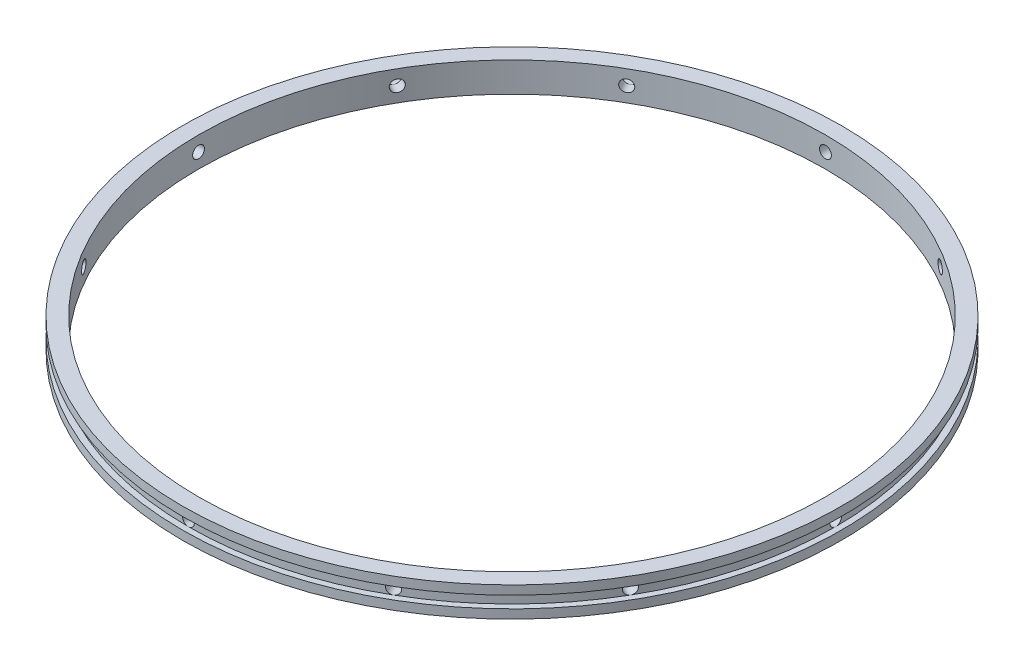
SolidWorks part; units mm, degrees
ref_plane "Front Plane" through (0, 0, 0) normal (0, 0, 1) x (1, 0, 0)
ref_plane "Top Plane" through (0, 0, 0) normal (0, 1, 0) x (1, 0, 0)
ref_plane "Right Plane" through (0, 0, 0) normal (1, 0, 0) x (0, 0, -1)
sketch "Sketch1-Lander Rotor Turntable Master sketch rev2" plane through (0, 0, 0) normal (0, 0, 1) x (1, 0, 0)
  line L0 (0, 0) -> (0, 36.1163) construction
  line L1 (54.356, 36.1163) -> (-54.356, 36.1163) construction
  line L2 (0, -76.5962) -> (50.8, -76.5962) construction
  line L3 (0, 0) -> (0, -76.5962) construction
  line L4 (0, 137.7163) -> (139.7, 137.7163)
  line L5 (139.7, 137.7163) -> (139.7, 112.3163)
  line L6 (139.7, 112.3163) -> (76.2, 112.3163)
  line L7 (76.2, 112.3163) -> (76.2, 39.2913)
  line L8 (50.8, -154.018) -> (50.8, -185.7527) construction
  line L9 (54.356, -189.3087) -> (-54.356, -189.3087) construction
  line L10 (38.1, -187.7212) -> (50.8254, -187.7212)
  line L12 (38.1, -187.7212) -> (38.1, -189.3087)
  line L13 (38.1, -189.3087) -> (38.1, -211.5337)
  line L14 (38.1, -211.5337) -> (64.8249, -211.5337)
  line L15 (104.9147, -187.7212) -> (104.9147, -182.4888)
  line L16 (104.9147, -182.4888) -> (113.8555, -182.4888)
  line L17 (0, -249.4089) -> (0, -76.5962) construction
  line L18 (0, 36.1163) -> (0, 137.7163) construction
  line L19 (0, -153.1925) -> (51.6255, -153.1925) construction
  line L20 (0, -153.1925) -> (-51.6255, -153.1925) construction
  line L21 (-78.5813, -156.0982) -> (-78.5813, -178.1658) construction
  line L22 (-65.4152, -152.7962) -> (-75.2793, -152.7962) construction
  line L23 (-73.7247, -178.9913) -> (-65.4152, -152.7962) construction
  line L24 (-77.7558, -178.9913) -> (-73.7247, -178.9913) construction
  line L25 (-58.9777, -150.6381) -> (-60.6029, -150.1668) construction
  line L26 (-59.3967, -152.0828) -> (-58.9777, -150.6381) construction
  line L27 (-60.119, -151.8733) -> (-59.3967, -152.0828) construction
  line L28 (-69.7973, -185.2447) -> (-60.119, -151.8733) construction
  line L29 (-71.2419, -184.8258) -> (-69.7973, -185.2447) construction
  line L30 (-61.3018, -150.5514) -> (-71.2419, -184.8258) construction
  line L31 (-64.8249, -180.7393) -> (-64.8249, -189.3087) construction
  line L32 (-61.8583, -181.5997) -> (-64.8249, -180.7393) construction
  line L33 (-55.9856, -159.2876) -> (-61.8583, -181.5997) construction
  line L34 (-58.9697, -158.4222) -> (-55.9856, -159.2876) construction
  line L35 (-58.9697, -153.1925) -> (-58.9697, -158.4222) construction
  line L36 (-64.8249, 36.1163) -> (-54.356, 36.1163) construction
  line L37 (-50.8, 32.5603) -> (-50.8, 0.8255) construction
  line L38 (-51.6255, 0) -> (-58.9697, 0) construction
  line L39 (-58.9697, 0) -> (-58.9697, 5.2297) construction
  line L40 (-58.9697, 5.2297) -> (-55.9856, 6.0951) construction
  line L41 (-55.9856, 6.0951) -> (-61.8583, 28.4072) construction
  line L42 (-61.8583, 28.4072) -> (-64.8249, 27.5468) construction
  line L43 (-64.8249, 27.5468) -> (-64.8249, 36.1163) construction
  line L44 (-61.3018, -2.6411) -> (-71.2419, 31.6333) construction
  line L45 (-71.2419, 31.6333) -> (-69.7973, 32.0523) construction
  line L46 (-69.7973, 32.0523) -> (-60.119, -1.3192) construction
  line L47 (-60.119, -1.3192) -> (-59.3967, -1.1097) construction
  line L48 (-59.3967, -1.1097) -> (-58.9777, -2.5543) construction
  line L49 (-58.9777, -2.5543) -> (-60.6029, -3.0257) construction
  line L50 (-77.7558, 25.7988) -> (-73.7247, 25.7988) construction
  line L51 (-73.7247, 25.7988) -> (-65.4152, -0.3962) construction
  line L52 (-65.4152, -0.3962) -> (-75.2793, -0.3962) construction
  line L53 (-78.5813, 2.9058) -> (-78.5813, 24.9733) construction
  line L54 (59.3967, -1.1097) -> (60.119, -1.3192) construction
  line L55 (60.119, -1.3192) -> (69.7973, 32.0523) construction
  line L56 (69.7973, 32.0523) -> (71.2419, 31.6333) construction
  line L57 (71.2419, 31.6333) -> (61.3018, -2.6411) construction
  line L58 (60.6029, -3.0257) -> (58.9777, -2.5543) construction
  line L59 (58.9777, -2.5543) -> (59.3967, -1.1097) construction
  line L60 (73.7247, 25.7988) -> (77.7557, 25.7988) construction
  line L61 (78.5812, 24.9733) -> (78.5813, 2.9058) construction
  line L62 (75.2793, -0.3962) -> (65.4152, -0.3962) construction
  line L63 (65.4152, -0.3962) -> (73.7247, 25.7988) construction
  line L64 (54.356, 36.1163) -> (64.8249, 36.1163) construction
  line L65 (64.8249, 36.1163) -> (64.8249, 27.5468) construction
  line L66 (64.8249, 27.5468) -> (61.8583, 28.4072) construction
  line L67 (61.8583, 28.4072) -> (55.9856, 6.0951) construction
  line L68 (55.9856, 6.0951) -> (58.9697, 5.2297) construction
  line L69 (58.9697, 5.2297) -> (58.9697, 0) construction
  line L70 (58.9697, 0) -> (51.6255, 0) construction
  line L71 (50.8, 0.8255) -> (50.8, 32.5603) construction
  line L72 (0, 0) -> (-51.6255, 0) construction
  line L73 (0, 0) -> (51.6255, 0) construction
  line L74 (-51.6255, -153.1925) -> (-58.9697, -153.1925) construction
  line L75 (-50.8, -185.7527) -> (-50.8, -154.018) construction
  line L76 (-64.8249, -189.3087) -> (-54.356, -189.3087) construction
  line L77 (0, -153.1925) -> (0, -189.3087) construction
  line L78 (58.9697, -153.1925) -> (51.6255, -153.1925) construction
  line L79 (58.9697, -158.4222) -> (58.9697, -153.1925) construction
  line L80 (55.9856, -159.2876) -> (58.9697, -158.4222) construction
  line L81 (61.8583, -181.5997) -> (55.9856, -159.2876) construction
  line L82 (64.8249, -180.7393) -> (61.8583, -181.5997) construction
  line L83 (64.8249, -189.3087) -> (64.8249, -180.7393) construction
  line L84 (54.356, -189.3087) -> (64.8249, -189.3087) construction
  line L85 (65.4152, -152.7962) -> (73.7247, -178.9913) construction
  line L86 (75.2793, -152.7962) -> (65.4152, -152.7962) construction
  line L87 (78.5812, -178.1658) -> (78.5812, -156.0982) construction
  line L88 (73.7247, -178.9913) -> (77.7557, -178.9913) construction
  line L89 (58.9777, -150.6381) -> (59.3967, -152.0828) construction
  line L90 (60.6029, -150.1668) -> (58.9777, -150.6381) construction
  line L91 (71.2419, -184.8258) -> (61.3018, -150.5514) construction
  line L92 (69.7973, -185.2447) -> (71.2419, -184.8258) construction
  line L93 (60.119, -151.8733) -> (69.7973, -185.2447) construction
  line L94 (59.3967, -152.0828) -> (60.119, -151.8733) construction
  line L95 (74.3669, 36.1163) -> (50.8254, 36.1163)
  line L96 (50.8254, 36.1163) -> (50.8254, -187.7212)
  line L97 (78.5558, -184.5462) -> (78.5559, -152.7962)
  line L98 (78.5559, -152.7962) -> (65.4152, -152.7962)
  line L99 (65.4152, -152.7962) -> (65.4152, -0.3962)
  line L100 (65.4152, -0.3962) -> (78.5558, -0.3962)
  line L101 (78.5558, -0.3962) -> (78.5559, 39.2913)
  line L102 (80.3889, 42.4663) -> (88.9, 42.4663)
  line L103 (88.9, 42.4663) -> (88.9, 75.8038)
  line L104 (89.8165, 77.3913) -> (125.4125, 77.3913)
  line L105 (125.4125, 77.3913) -> (125.4125, -186.1337)
  line L109 (76.2, 39.2913) -> (74.3669, 36.1163)
  line L110 (88.9, 75.8038) -> (89.8165, 77.3913)
  line L112 (78.5559, 39.2913) -> (80.3889, 42.4663)
  line L148 (80.3889, -187.7212) -> (123.825, -187.7212)
  line L149 (78.5558, -184.5462) -> (80.3889, -187.7212)
  line L150 (38.1, -213.1212) -> (44.8818, -213.1212)
  line L151 (38.1, -211.5337) -> (38.1, -213.1212)
  line L152 (44.8818, -213.1212) -> (44.8818, -281.5337)
  line L153 (43.2943, -283.1212) -> (24.9746, -283.1212)
  line L154 (44.8818, -281.5337) -> (43.2943, -283.1212)
  line L155 (123.825, -187.7212) -> (125.4125, -186.1337)
  line L156 (131.7625, -132.1587) -> (131.7625, -126.9263) construction
  line L157 (131.7625, -126.9263) -> (140.7033, -126.9263) construction
  line L161 (140.7033, -126.9263) -> (140.7033, -132.1587) construction
  line L167 (125.6665, -132.1587) -> (125.6665, -182.9587)
  line L168 (50.8254, -149.9413) -> (45.1104, -149.9413) construction
  line L169 (145.7833, -126.9263) -> (145.7833, -132.1587) construction
  line L170 (45.1104, -149.9413) -> (45.1104, -153.1163) construction
  line L171 (45.1104, -153.1163) -> (50.8254, -153.1163) construction
  line L172 (64.8249, -211.5337) -> (64.8249, -189.3087)
  line L174 (64.8249, -189.3087) -> (38.1, -189.3087)
  line L175 (51.4625, -211.5337) -> (51.4625, -189.3087) construction
  line L176 (64.8249, -200.4212) -> (51.4625, -200.4212) construction
  line L177 (154.7241, -126.9263) -> (154.7241, -132.1587) construction
  line L182 (154.7241, -126.9263) -> (145.7833, -126.9263) construction
  line L184 (81.9, -187.7212) -> (125.4125, -187.7212)
  line L185 (431.8, -182.9587) -> (431.8, -132.1587)
  line L186 (431.8, -132.1587) -> (203.2, -132.1587)
  line L187 (81.9, -218.1225) -> (98.1397, -218.1225)
  line L189 (304.8, -221.0587) -> (304.8, -182.9587)
  line L190 (81.9, -218.1225) -> (81.9, -187.7212)
  line L193 (81.9, -187.7212) -> (80.3889, -187.7212)
  line L194 (98, -218.1225) -> (98, -236.1225) construction
  line L195 (98, -236.1225) -> (74.5, -236.1225) construction
  line L196 (74.5, -236.1225) -> (74.5, -438.649) construction
  line L199 (74.5, -438.649) -> (0, -438.649) construction
  line L203 (0, -438.649) -> (0, -428.649)
  line L204 (0, -428.649) -> (81.9, -428.649) construction
  line L205 (81.9, -428.649) -> (81.9, -218.1225) construction
  line L206 (89.0397, -187.7212) -> (89.0397, -182.4888)
  line L207 (89.0397, -182.4888) -> (97.9805, -182.4888)
  line L208 (97.9805, -182.4888) -> (97.9805, -187.7212)
  line L210 (125.4125, -94.0587) -> (203.2, -94.0587)
  line L211 (203.2, -94.0587) -> (203.2, -132.1587)
  line L213 (78.5559, -168.6712) -> (125.4125, -168.6712) construction
  line L214 (0, 137.7163) -> (0, 188.5163)
  line L215 (0, -249.4089) -> (0, 137.7163)
  line L219 (304.8, -259.1587) -> (304.8, -221.0587)
  line L220 (304.8, -259.1587) -> (279.4, -259.1587) construction
  line L221 (260.35, -278.2087) -> (260.35, -817.9587) construction
  line L222 (260.35, -817.9587) -> (0, -817.9587) construction
  line L225 (0, -817.9587) -> (0, -792.5587) construction
  line L226 (0, -792.5587) -> (228.6, -792.5587) construction
  line L228 (50.8254, -140.4925) -> (47.6504, -140.4925)
  line L229 (47.6504, -140.4925) -> (47.6504, -12.7)
  line L230 (47.6504, -12.7) -> (50.8254, -12.7)
  line L231 (203.2, -132.1587) -> (125.4125, -132.1587)
  line L238 (254, -767.1587) -> (254, -221.0587) construction
  line L239 (203.454, -218.1225) -> (203.454, -221.0587)
  line L240 (203.454, -239.6719) -> (127, -239.6719) construction
  line L241 (0, -249.4089) -> (0, -420.074) construction
  line L242 (127, -239.6719) -> (127, -218.1225) construction
  line L243 (152.4, -239.6719) -> (152.4, -407.9469) construction
  line L244 (152.4, -407.9469) -> (127, -407.9469) construction
  line L245 (127, -407.9469) -> (127, -239.6719) construction
  line L246 (127, -407.9469) -> (203.454, -407.9469) construction
  line L247 (203.454, -407.9469) -> (203.454, -433.3469) construction
  line L248 (203.454, -433.3469) -> (127, -433.3469) construction
  line L249 (127, -433.3469) -> (127, -407.9469) construction
  line L250 (203.454, -221.0587) -> (304.8, -221.0587)
  line L251 (43.2943, -283.1212) -> (71, -283.1212) construction
  line L252 (203.454, -221.0587) -> (203.454, -239.6719) construction
  line L253 (71, -283.1212) -> (71, -420.074) construction
  line L254 (125.6665, -182.9587) -> (304.8, -182.9587)
  line L255 (125.6665, -182.9587) -> (125.4125, -182.9587)
  line L256 (125.6665, -182.9587) -> (125.6665, -187.7212)
  line L257 (125.6665, -187.7212) -> (125.4125, -187.7212)
  line L258 (304.8, -182.9587) -> (431.8, -182.9587)
  line L259 (71, -420.074) -> (0, -420.074) construction
  line L260 (76.2, 112.3163) -> (76.2, 137.7163)
  line L261 (76.327, 112.3163) -> (76.327, 137.7163)
  line L262 (98.1397, -218.1225) -> (98.1397, -220.6219)
  line L263 (98.1397, -220.6219) -> (126.746, -220.6219)
  line L264 (24.9746, -283.1212) -> (24.9746, -353.1542)
  line L265 (24.9746, -353.1542) -> (0, -353.1542)
  line L266 (0, -353.1542) -> (0, -249.4089)
  line L267 (24.9746, -346.8042) -> (23.1902, -346.8042)
  line L268 (23.1902, -346.8042) -> (23.1902, -343.1212)
  line L269 (23.1902, -343.1212) -> (24.9746, -343.1212)
  line L270 (0, 188.5163) -> (139.7, 188.5163)
  line L271 (139.7, 188.5163) -> (139.7, 137.7163)
  line L272 (127, -239.6719) -> (126.746, -239.6719) construction
  line L273 (126.746, -239.6719) -> (126.746, -220.6219) construction
  line L274 (127, -218.1225) -> (203.454, -218.1225)
  line L275 (126.746, -220.6219) -> (126.746, -218.1225)
  line L276 (126.746, -218.1225) -> (127, -218.1225)
  line L277 (113.8555, -182.4888) -> (113.8555, -187.7212)
  arc A0 (50.8, -154.018) -> (51.6255, -153.1925) centre (51.6255, -154.018) cw construction
  arc A1 (-77.7558, -178.9913) -> (-78.5813, -178.1658) centre (-77.7558, -178.1658) cw construction
  arc A2 (-78.5813, -156.0982) -> (-75.2793, -152.7962) centre (-75.2793, -156.0982) cw construction
  arc A3 (-61.3018, -150.5514) -> (-60.6029, -150.1668) centre (-60.7601, -150.7085) cw construction
  arc A4 (-51.6255, -153.1925) -> (-50.8, -154.018) centre (-51.6255, -154.018) cw construction
  arc A5 (-50.8, -185.7527) -> (-54.356, -189.3087) centre (-54.356, -185.7527) cw construction
  arc A6 (54.356, -189.3087) -> (50.8, -185.7527) centre (54.356, -185.7527) cw construction
  arc A7 (75.2793, -152.7962) -> (78.5812, -156.0982) centre (75.2793, -156.0982) cw construction
  arc A8 (78.5812, -178.1658) -> (77.7557, -178.9913) centre (77.7557, -178.1658) cw construction
  arc A9 (60.6029, -150.1668) -> (61.3018, -150.5514) centre (60.7601, -150.7085) cw construction
  arc A10 (-50.8, 32.5603) -> (-54.356, 36.1163) centre (-54.356, 32.5603) ccw construction
  arc A11 (-51.6255, 0) -> (-50.8, 0.8255) centre (-51.6255, 0.8255) ccw construction
  arc A12 (-61.3018, -2.6411) -> (-60.6029, -3.0257) centre (-60.7601, -2.4839) ccw construction
  arc A13 (-78.5813, 2.9058) -> (-75.2793, -0.3962) centre (-75.2793, 2.9058) ccw construction
  arc A14 (-77.7558, 25.7988) -> (-78.5813, 24.9733) centre (-77.7558, 24.9733) ccw construction
  arc A15 (60.6029, -3.0257) -> (61.3018, -2.6411) centre (60.7601, -2.4839) ccw construction
  arc A16 (78.5812, 24.9733) -> (77.7557, 25.7988) centre (77.7557, 24.9733) ccw construction
  arc A17 (75.2793, -0.3962) -> (78.5813, 2.9058) centre (75.2793, 2.9058) ccw construction
  arc A18 (50.8, 0.8255) -> (51.6255, 0) centre (51.6255, 0.8255) ccw construction
  arc A19 (54.356, 36.1163) -> (50.8, 32.5603) centre (54.356, 32.5603) ccw construction
  circle A20 centre (51.4625, -200.4212) radius 7.9375
  circle A21 centre (51.4625, -200.4212) radius 4.7625
  arc A22 (254, -767.1587) -> (228.6, -792.5587) centre (228.6, -767.1587) cw construction
  arc A23 (279.4, -259.1587) -> (260.35, -278.2087) centre (279.4, -278.2087) ccw construction
  point P63 (76.2, 36.1163)
  point P138 (78.5558, 42.4663)
  point P139 (44.8818, -283.1212)
  point P142 (88.9, 77.3913)
  point P148 (125.4125, -187.7212)
  point P182 (78.5558, -187.7212)
  point P214 (260.35, -259.1587)
  point P230 (127, -228.8972)
  dimension "D31" = 0.254
  dimension "D14" = 8.575
  dimension "D32" = 1.5875
  dimension "D33" = 1.5875
  dimension "D34" = 0.0762
  dimension "D40" = 9.525
  dimension "D42" = 15.875
  dimension "D45" = 8.9408
  dimension "D51" = 25.4
  dimension "D52" = 19.05
  dimension "D1" = 101.6
  dimension "D2" = 76.2
  dimension "D3" = 101.6508
  dimension "D4" = 152.4
  dimension "D5" = 279.4
  dimension "D6" = 25.4
  dimension "D7" = 76.2
  dimension "D8" = 1.5875
  dimension "D9" = 44.8818
  dimension "D10" = 38.1
  dimension "D11" = 1.5875
  dimension "D12" = 6.35
  dimension "D13" = 22.225
  dimension "D15" = 157.1117
  dimension "D16" = 177.8
  dimension "D17" = 34.925
  dimension "D23" = 30
  dimension "D84" = 3.175
  dimension "D18" = 250.825
  dimension "D24" = 1.5875
  dimension "D86" = 30
  dimension "D20" = 8.9408
  dimension "D19" = 130.8303
  dimension "D85" = 3.175
  dimension "D28" = 30
  dimension "D21" = 5.2324
  dimension "D22" = 6.35
  dimension "D26" = 70
  dimension "D27" = 38.1
  dimension "D30" = 3.175
  dimension "D35" = 3.175
  dimension "D36" = 45.1104
  dimension "D25" = 5.08
  dimension "D37" = 58.9697
  dimension "D38" = 64.8249
  dimension "D87" = 30
  dimension "D29" = 863.6
  dimension "D39" = 54.356
  dimension "D41" = 609.6
  dimension "D43" = 3.175
  dimension "D44" = 5.2324
  dimension "D46" = 227.711
  dimension "D47" = 558.8
  dimension "D48" = 25.4
  dimension "D49" = 6.35
  dimension "D50" = 260.35
  dimension "D53" = 38.1
  dimension "D54" = 406.4
  dimension "D55" = 12.7
  dimension "D56" = 12.7
  dimension "D57" = 3.175
  dimension "D58" = 406.908
  dimension "D59" = 127
  dimension "D60" = 168.275
  dimension "D61" = 81.9
  dimension "D62" = 25.4
  dimension "D63" = 25.4
  dimension "D64" = 30.4013
  dimension "D65" = 0.254
  dimension "D66" = 38.1
  dimension "D67" = 50.8
  dimension "D68" = 71
  dimension "D69" = 60
  dimension "D70" = 18
  dimension "D71" = 98
  dimension "D72" = 74.5
  dimension "D73" = 10
  dimension "D74" = 220.5265
  dimension "D75" = 0.127
  dimension "D76" = 0.1397
  dimension "D77" = 19.05
  dimension "D79" = 49.9492
  dimension "D80" = 46.3804
  dimension "D81" = 3.683
  dimension "D83" = 195.961
  dimension "D88" = 50.8
  dimension "D89" = 0.254
  dimension "D90" = 2.4994
inserted part "Lander Rotor Turntable Master sketch rev2"
move or copy body "Body-Move/Copy2"
sketch "Sketch2" plane through (0, 0, 0) normal (0, 0, 1) x (1, 0, 0)
  line L0 (88.9, 75.8038) -> (89.8165, 77.3913) construction
  line L1 (88.9, 42.4663) -> (88.9, 75.8038) construction
  line L2 (0, -249.4089) -> (0, 137.7163) construction
  line L3 (88.9, 75.8038) -> (89.8165, 77.3913) construction
  line L4 (88.9, 42.4663) -> (88.9, 75.8038) construction
  line L5 (0, -249.4089) -> (0, 137.7163) construction
  line L6 (78.5559, 39.2913) -> (80.3889, 42.4663) construction
  line L7 (80.3889, 42.4663) -> (88.9, 42.4663) construction
  line L8 (78.5559, 39.2913) -> (80.3889, 42.4663) construction
  line L9 (80.3889, 42.4663) -> (88.9, 42.4663) construction
  line L10 (84.3788, 53.5661) -> (84.3788, 61.5467)
  line L11 (84.3788, 61.5467) -> (88.6968, 61.5467)
  line L12 (88.6968, 61.5467) -> (88.6968, 53.5661)
  line L13 (88.6968, 53.5661) -> (84.3788, 53.5661)
  line L14 (84.3788, 57.5564) -> (88.6968, 57.5564) construction
  line L15 (88.6968, 55.9689) -> (87.1093, 55.9689)
  line L16 (87.1093, 55.9689) -> (87.1093, 59.1439)
  line L17 (87.1093, 59.1439) -> (88.6968, 59.1439)
  point P19 (87.1093, 57.5564)
  dimension "D1" = 11.0998
  dimension "D2" = 7.9807
  dimension "D3" = 4.318
  dimension "D4" = 0.2032
  dimension "D5" = 3.175
  dimension "D6" = 1.5875
revolve "Revolve1" add sketch "Sketch2" angle 360 about L5
sketch "Sketch4" plane through (0, 0, 0) normal (1, 0, 0) x (0, 0, -1)
  line L0 (84.3788, 61.5467) -> (-84.3788, 61.5467) construction
  line L1 (-84.3788, 53.5661) -> (84.3788, 53.5661) construction
  line L2 (84.3788, 61.5467) -> (-84.3788, 61.5467) construction
  line L3 (-84.3788, 53.5661) -> (84.3788, 53.5661) construction
  line L4 (0, 53.5661) -> (0, 61.5467) construction
  circle A0 centre (0, 57.5564) radius 1.5875
  point P6 (0, 57.5564)
  dimension "D1" = 3.175
extrude "Cut-Extrude3" cut sketch "Sketch4" against normal through all
pattern_circular "CirPattern2" count 12 over 360 about axis through (0, -249.4089, 0) along (0, -1, 0) of "Cut-Extrude3"
